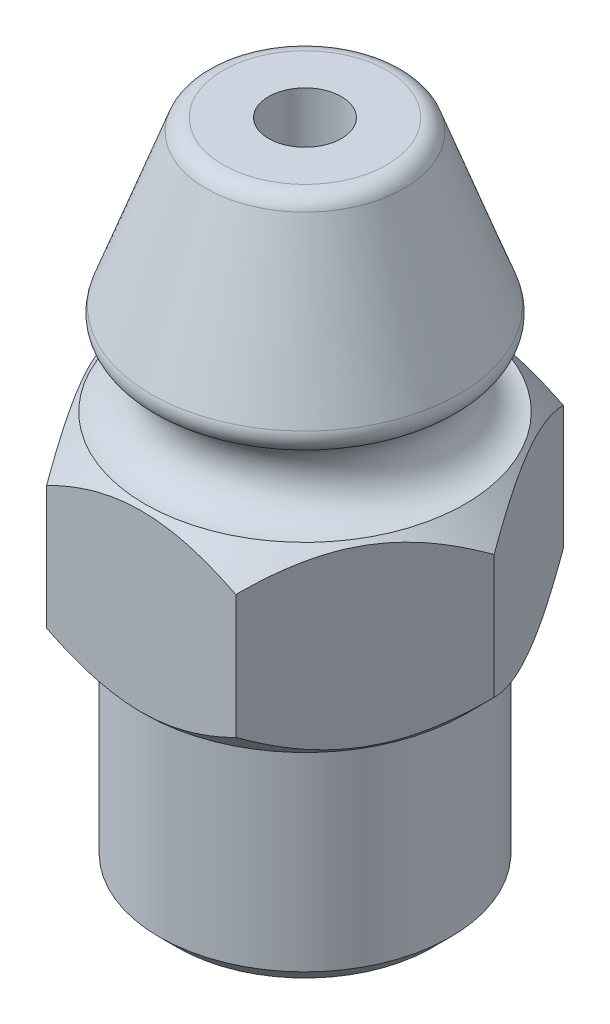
SolidWorks part; units mm, degrees
ref_plane "Face" through (0, 0, 0) normal (0, 0, 1) x (1, 0, 0)
ref_plane "Dessus" through (0, 0, 0) normal (0, 1, 0) x (1, 0, 0)
ref_plane "Droite" through (0, 0, 0) normal (1, 0, 0) x (0, 0, -1)
sketch "Esquisse2" plane through (0, 0, 0) normal (0, 1, 0) x (1, 0, 0)
  circle A0 centre (0, 0) radius 4
  dimension "D1" = 8
extrude "Extrusion1" add sketch "Esquisse2" against normal blind 6
chamfer "Chanfrein1" distance 0.5 angle 45 1 edges at (0, -6, 4)
sketch "Esquisse3" plane through (0, 0, 0) normal (0, 1, 0) x (-1, 0, 0)
  line L1 (5.1962, 0) -> (2.5981, 4.5)
  line L2 (2.5981, 4.5) -> (-2.5981, 4.5)
  line L3 (-2.5981, 4.5) -> (-5.1962, 0)
  line L4 (-5.1962, 0) -> (-2.5981, -4.5)
  line L5 (-2.5981, -4.5) -> (2.5981, -4.5)
  line L6 (2.5981, -4.5) -> (5.1962, 0)
  circle A0 centre (0, 0) radius 4.5 construction
  dimension "D1" = 9
extrude "Extrusion2" add sketch "Esquisse3" along normal blind 5
sketch "Esquisse4" plane through (0, 0, 0) normal (0, 0, 1) x (1, 0, 0)
  line L0 (4.3962, 5) -> (5.1962, 5)
  line L1 (2.5981, 5) -> (5.1962, 5) construction
  line L2 (5.1962, 5) -> (5.1962, 4.2)
  line L3 (5.1962, 5) -> (5.1962, 0) construction
  line L4 (5.1962, 4.2) -> (4.3962, 5)
  dimension "D1" = 0.8
revolve "Enlèvement de matière-Révolution1" cut sketch "Esquisse4" angle 360 about axis through (0, -6, 0) along (0, 1, 0)
ref_plane "Plan1" through (0, 2.5, 0) normal (0, 1, 0) x (-1, 0, 0)
mirror "Symétrie1" about plane through (0, 2.5, 0) normal (0, 1, 0) of "Enlèvement de matière-Révolution1"
sketch "Esquisse5" plane through (0, 0, 0) normal (0, 0, 1) x (1, 0, 0)
  line L0 (4.3962, 5) -> (-4.3962, 5) construction
  line L1 (-4.42, 6.9997) -> (-2.6, 12)
  line L2 (-2.6, 12) -> (0, 12)
  line L3 (0, 12) -> (0, 5)
  line L4 (0, -5.5) -> (0, 0) construction
  line L5 (0, 5) -> (-4.3962, 5)
  arc A0 (-4.3962, 5) -> (-4.42, 6.9997) centre (-4.3962, 6) ccw
  point P1 (0, 0)
  dimension "D1" = 2
  dimension "D2" = 7
  dimension "D3" = 2.6
  dimension "D4" = 20
revolve "Révolution2" add sketch "Esquisse5" angle 360 about L3
fillet "Congé2" radius 0.5 2 edges at (0, 12, 2.6) (0, 6.9997, 4.42)
sketch "Esquisse6" plane through (0, 12, 0) normal (0, 1, 0) x (-1, 0, 0)
  circle A0 centre (0, 0) radius 1
  dimension "D1" = 2
extrude "Enlèv. mat.-Extru.1" cut sketch "Esquisse6" against normal through all
